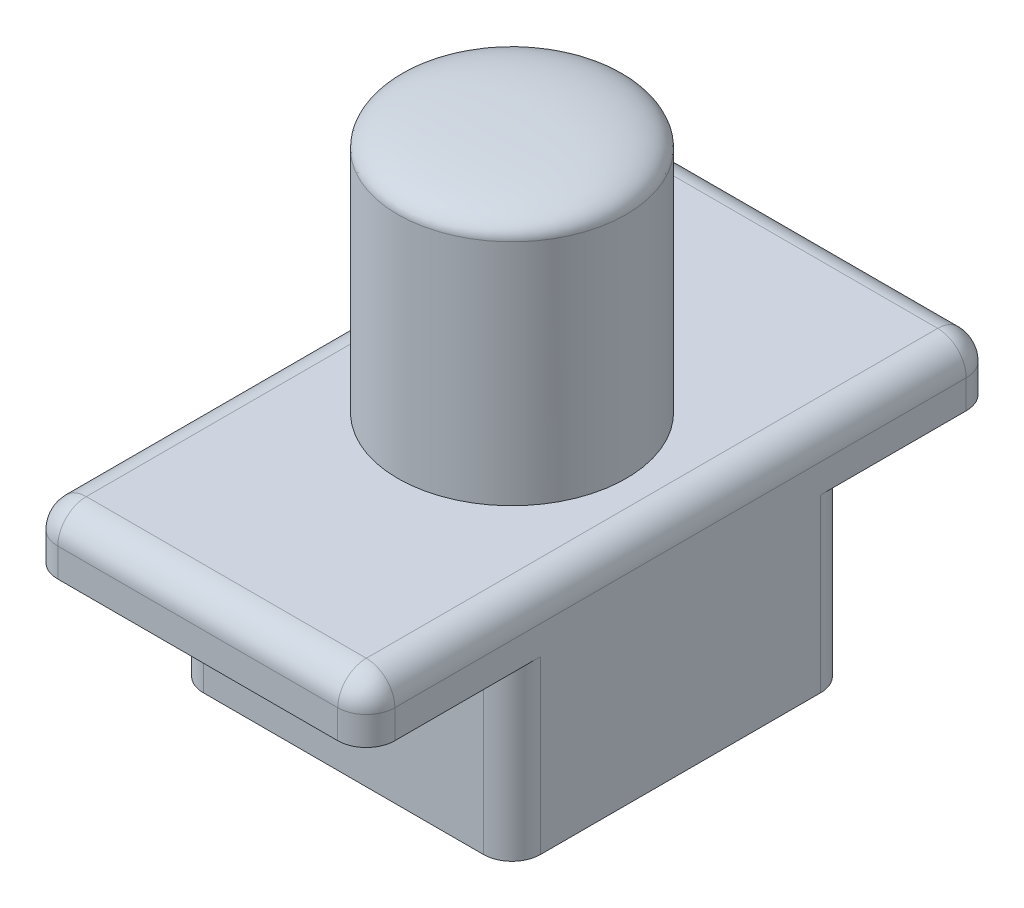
SolidWorks part; units mm, degrees
ref_plane "Front Plane" through (0, 0, 0) normal (0, 0, 1) x (1, 0, 0)
ref_plane "Top Plane" through (0, 0, 0) normal (0, 1, 0) x (1, 0, 0)
ref_plane "Right Plane" through (0, 0, 0) normal (1, 0, 0) x (0, 0, -1)
sketch "Sketch1" plane through (0, 0, 0) normal (1, 0, 0) x (0, 0, -1)
  line L0 (-5.5, 4) -> (5.5, 4)
  line L1 (-2.95, 0) -> (-2.95, 3)
  line L2 (-2.95, 3) -> (-5.5, 3)
  line L3 (0, 4) -> (0, 0) construction
  line L4 (2.95, 0) -> (-2.95, 0)
  line L5 (2.95, 0) -> (2.95, 3)
  line L6 (0, 4) -> (0, 0) construction
  line L7 (-5.5, 3) -> (-5.5, 4)
  line L8 (2.95, 3) -> (5.5, 3)
  line L9 (5.5, 3) -> (5.5, 4)
  dimension "D1" = 4
  dimension "D2" = 2.95
  dimension "D3" = 3
  dimension "D4" = 2.55
extrude "Extrude1" add sketch "Sketch1" along normal mid plane 5.9
sketch "Sketch2" plane through (0, 4, 0) normal (0, 1, 0) x (1, 0, 0)
  circle A0 centre (0, 0) radius 2
  dimension "D1" = 4
extrude "Extrude2" add sketch "Sketch2" along normal blind 4
sketch "Sketch3" plane through (0, 0, 0) normal (0, 0, 1) x (1, 0, 0)
  line L0 (0, 8) -> (2, 8)
  line L1 (0, 8) -> (0, 8.5)
  line L2 (2, 8) -> (-2, 8) construction
  line L3 (2, 8) -> (-2, 8) construction
  spline S1 degree 3 poles (0, 8.5) (0.2102, 8.5) (0.5195, 8.494) (0.9136, 8.4676) (1.1973, 8.4359) (1.4649, 8.3882) (1.6687, 8.3293) (1.8125, 8.2628) (1.9067, 8.1994) (1.9758, 8.1184) (2.0004, 8.0454) (2, 8) knots 0 0 0 0 0.25 0.375 0.5 0.625 0.75 0.8125 0.875 0.9375 0.990999 0.990999 0.990999 0.990999
  dimension "D2" = 0.5
revolve "Revolve1" add sketch "Sketch3" angle 360 about L1
fillet "Fillet1" radius 0.5 12 edges at (0, 4, 5.5) (-2.95, 4, 0) (0, 4, -5.5) (2.95, 4, 0) (-2.95, 1.5, 2.95) (-2.95, 1.5, -2.95) (2.95, 1.5, -2.95) (2.95, 1.5, 2.95) (2.95, 3.5, 5.5) (-2.95, 3.5, 5.5) (-2.95, 3.5, -5.5) (2.95, 3.5, -5.5)
sketch "Sketch4" plane through (0, 0, 0) normal (0, -1, 0) x (1, 0, 0)
  line L2 (1.9989, 2.45) -> (1.9989, -2.45)
  line L3 (1.9989, 1.9989) -> (1.9989, -1.9989)
  line L5 (2.45, -1.9989) -> (-2.45, -1.9989)
  line L6 (1.9989, -1.9989) -> (-1.9989, -1.9989)
  line L8 (-1.9989, 2.45) -> (-1.9989, -2.45)
  line L9 (-1.9989, 1.9989) -> (-1.9989, -1.9989)
  line L11 (2.45, 1.9989) -> (-2.45, 1.9989)
  line L12 (1.9989, 1.9989) -> (-1.9989, 1.9989)
  dimension "D1" = 0.9511
  dimension "D2" = 0.9511
  dimension "D3" = 0.9511
  dimension "D4" = 0.9511
extrude "Cut-Extrude1" cut sketch "Sketch4" against normal blind 2.8
sketch "Sketch5" plane through (0, 2.8, 0) normal (0, -1, 0) x (1, 0, 0)
  circle A0 centre (0, 0) radius 0.75
  dimension "D1" = 1.5
extrude "Cut-Extrude2" cut sketch "Sketch5" against normal blind 0.2
